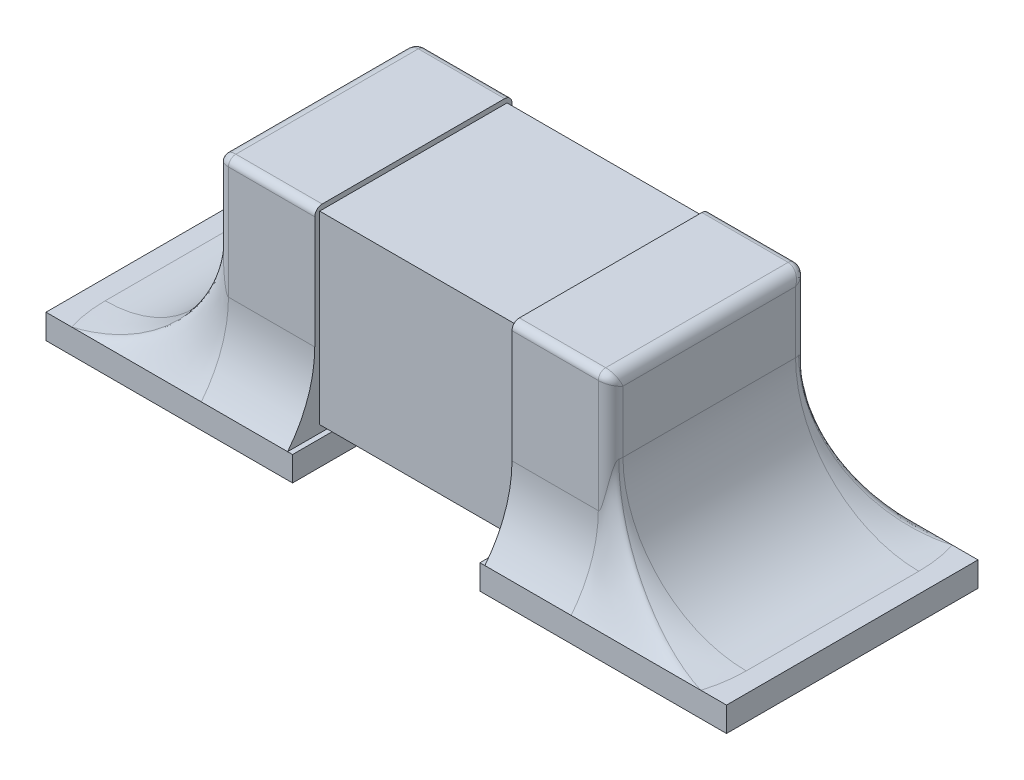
SolidWorks part; units mm, degrees
ref_plane "Plan de face" through (0, 0, 0) normal (0, 0, 1) x (1, 0, 0)
ref_plane "Plan de dessus" through (0, 0, 0) normal (0, 1, 0) x (1, 0, 0)
ref_plane "Plan de droite" through (0, 0, 0) normal (1, 0, 0) x (0, 0, -1)
sketch "Esquisse1" plane through (0, 0, 0) normal (1, 0, 0) x (0, 0, -1)
  line L1 (-0.38, 0.88) -> (0.38, 0.88)
  line L2 (-0.38, 0.88) -> (-0.38, 0.13)
  line L3 (-0.38, 0.13) -> (0.38, 0.13)
  line L4 (0.38, 0.88) -> (0.38, 0.13)
  dimension "D1" = 0.13
  dimension "D2" = 0.38
  dimension "D3" = 0.76
  dimension "D4" = 0.75
extrude "Extrusion1" add sketch "Esquisse1" along normal mid plane 0.8
sketch "Esquisse2" plane through (-0.4, 0, -0.4) normal (1, 0, 0) x (0, 0, -1)
  line L5 (-0.77, 0.9) -> (-0.03, 0.9)
  line L6 (-0.8, 0.87) -> (-0.8, 0.1)
  line L7 (-0.8, 0.1) -> (0, 0.1)
  line L8 (0, 0.87) -> (0, 0.1)
  arc A0 (0, 0.87) -> (-0.03, 0.9) centre (-0.03, 0.87) ccw
  arc A1 (-0.8, 0.87) -> (-0.77, 0.9) centre (-0.77, 0.87) cw
  dimension "D4" = 0.8
  dimension "D5" = 0.03
  dimension "D2" = 0.8
  dimension "D3" = 0.4
  dimension "D1" = 0.1
extrude "Extrusion2" add sketch "Esquisse2" against normal blind 0.4
mirror "Symétrie1" about plane through (0, 0, 0) normal (1, 0, 0) of "Extrusion2"
sketch "Esquisse3" plane through (0, 0.1, 0) normal (0, -1, 0) x (1, 0, 0)
  line L0 (0, 0) -> (0, -0.5421) construction
  line L1 (-0.38, 0.51) -> (-1.38, 0.51)
  line L2 (-0.38, 0.51) -> (-0.38, -0.51)
  line L3 (-0.38, -0.51) -> (-1.38, -0.51)
  line L4 (-1.38, 0.51) -> (-1.38, -0.51)
  line L5 (1.38, 0.51) -> (1.38, -0.51)
  line L6 (0.38, -0.51) -> (1.38, -0.51)
  line L7 (0.38, 0.51) -> (0.38, -0.51)
  line L8 (0.38, 0.51) -> (1.38, 0.51)
  dimension "D1" = 0.38
  dimension "D2" = 1
  dimension "D3" = 0.51
  dimension "D4" = 1.02
extrude "Extrusion3" add sketch "Esquisse3" along normal blind 0.1
fillet "Congé1" radius 0.05 10 edges at (-0.8, 0.485, -0.4) (-0.8, 0.485, 0.4) (-0.8, 0.8912, 0.3912) (-0.8, 0.9, 0) (-0.8, 0.8912, -0.3912) (0.8, 0.485, -0.4) (0.8, 0.8912, -0.3912) (0.8, 0.9, 0) (0.8, 0.8912, 0.3912) (0.8, 0.485, 0.4)
fillet "Congé2" radius 0.5 12 edges at (0.8, 0.1, 0) (0.575, 0.1, -0.4) (-0.575, 0.1, -0.4) (-0.75, 0.485, -0.4) (-0.8, 0.1, 0) (0.575, 0.1, 0.4) (0.75, 0.485, 0.4) (-0.575, 0.1, 0.4) (0.7854, 0.1, -0.3854) (-0.7854, 0.1, -0.3854) (0.7854, 0.1, 0.3854) (-0.7854, 0.1, 0.3854)
